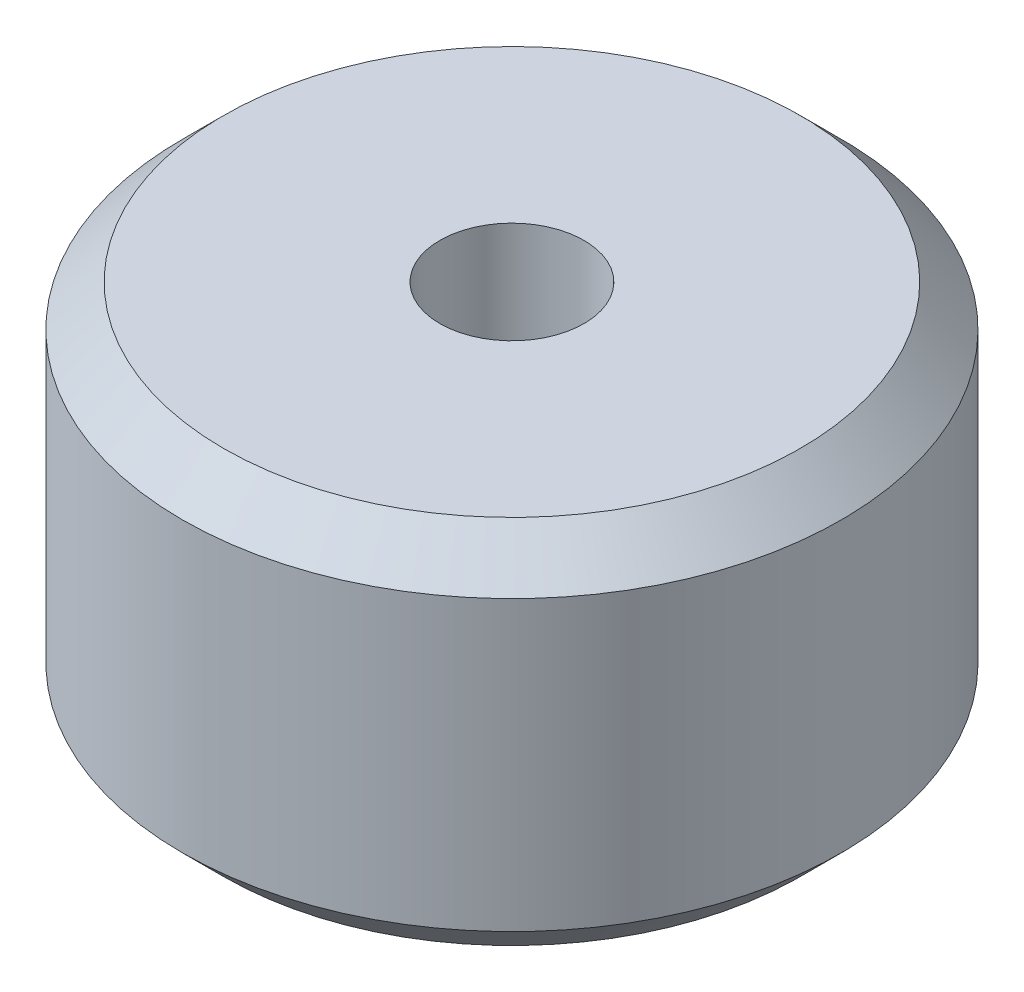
SolidWorks part; units mm, degrees
ref_plane "Front" through (0, 0, 0) normal (0, 0, 1) x (1, 0, 0)
ref_plane "Top" through (0, 0, 0) normal (0, 1, 0) x (1, 0, 0)
ref_plane "Right" through (0, 0, 0) normal (1, 0, 0) x (0, 0, -1)
sketch "Sketch1" plane through (0, 0, 0) normal (0, 1, 0) x (1, 0, 0)
  circle A0 centre (0, 0) radius 1.75
  circle A1 centre (0, 0) radius 8
extrude "Extrude1" add sketch "Sketch1" along normal blind 9
chamfer "Chamfer1" distance 1 angle 45 2 edges at (0, 0, 8) (0, 9, 8)
